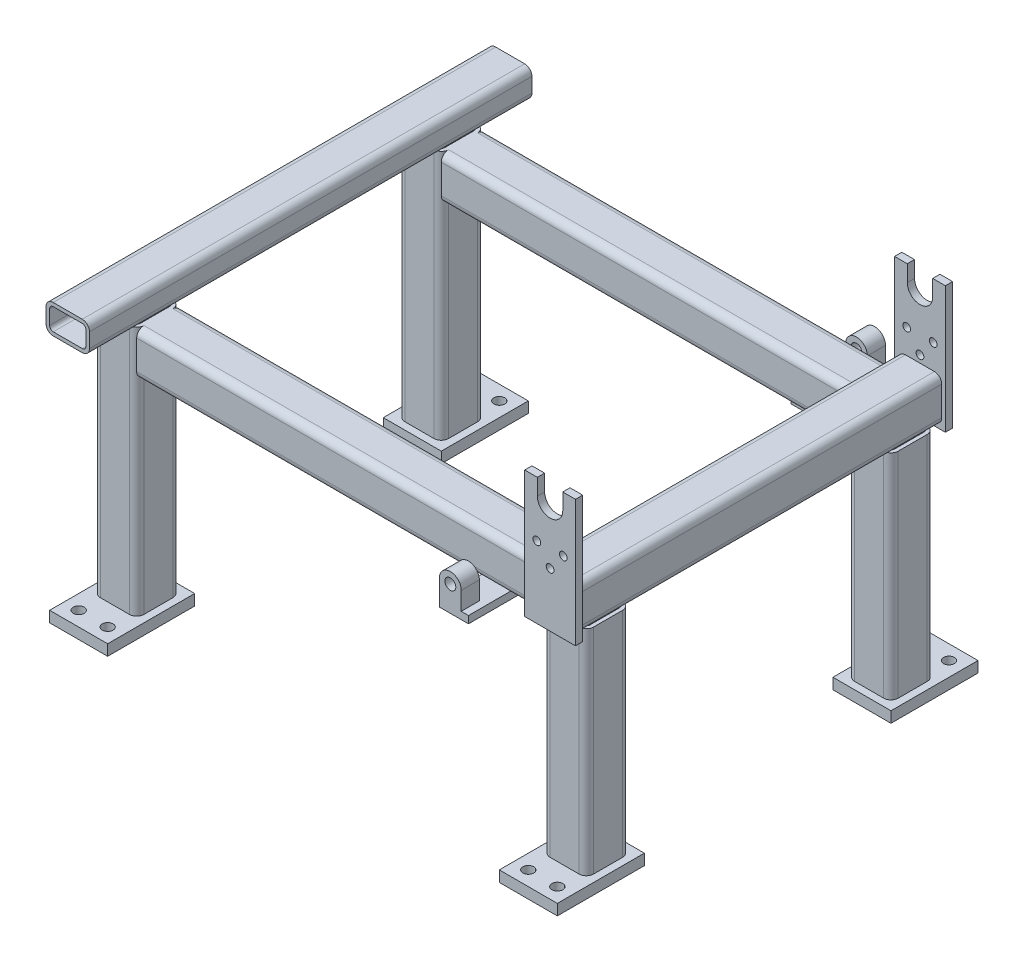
SolidWorks part; units mm, degrees
ref_plane "Front Plane" through (0, 0, 0) normal (0, 0, 1) x (1, 0, 0)
ref_plane "Top Plane" through (0, 0, 0) normal (0, 1, 0) x (1, 0, 0)
ref_plane "Right Plane" through (0, 0, 0) normal (1, 0, 0) x (0, 0, -1)
imported_body "frame part"
hole_wizard "1/4 (0.25) Diameter Hole1" positions "Sketch2" profile "Sketch1" hole size "1/4" standard "Ansi Inch"
sketch "Sketch2" plane through (372.0112, 69.2916, 228.6) normal (0, 0, 1) x (1, 0, 0)
  line L1 (-410.1112, -323.2916) -> (-473.6112, -323.2916) construction
  line L2 (-372.0112, -685.2416) -> (-372.0112, -374.0916) construction
  line L3 (-346.6112, -685.2416) -> (-397.4112, -685.2416) construction
  point P0 (-372.0112, -374.0916)
  dimension "D2" = 50.8
sketch "Sketch1" plane through (0, -304.8, 228.6) normal (1, 0, 0) x (0, 1, 0)
  line L0 (0, 0) -> (0, 6.35)
  line L1 (0, 6.35) -> (3.175, 6.35)
  line L2 (3.175, 6.35) -> (3.175, 0)
  line L5 (3.175, 0) -> (0, 0)
  line L11 (0, -6.35) -> (0, 107.95) construction
  dimension "Thru Hole Dia." = 6.35
  dimension "Thru Hole Depth" = 6.35
pattern_linear "LPattern1" count 5 spacing 63.5 along (0, -1, 0) of "1/4 (0.25) Diameter Hole1"
